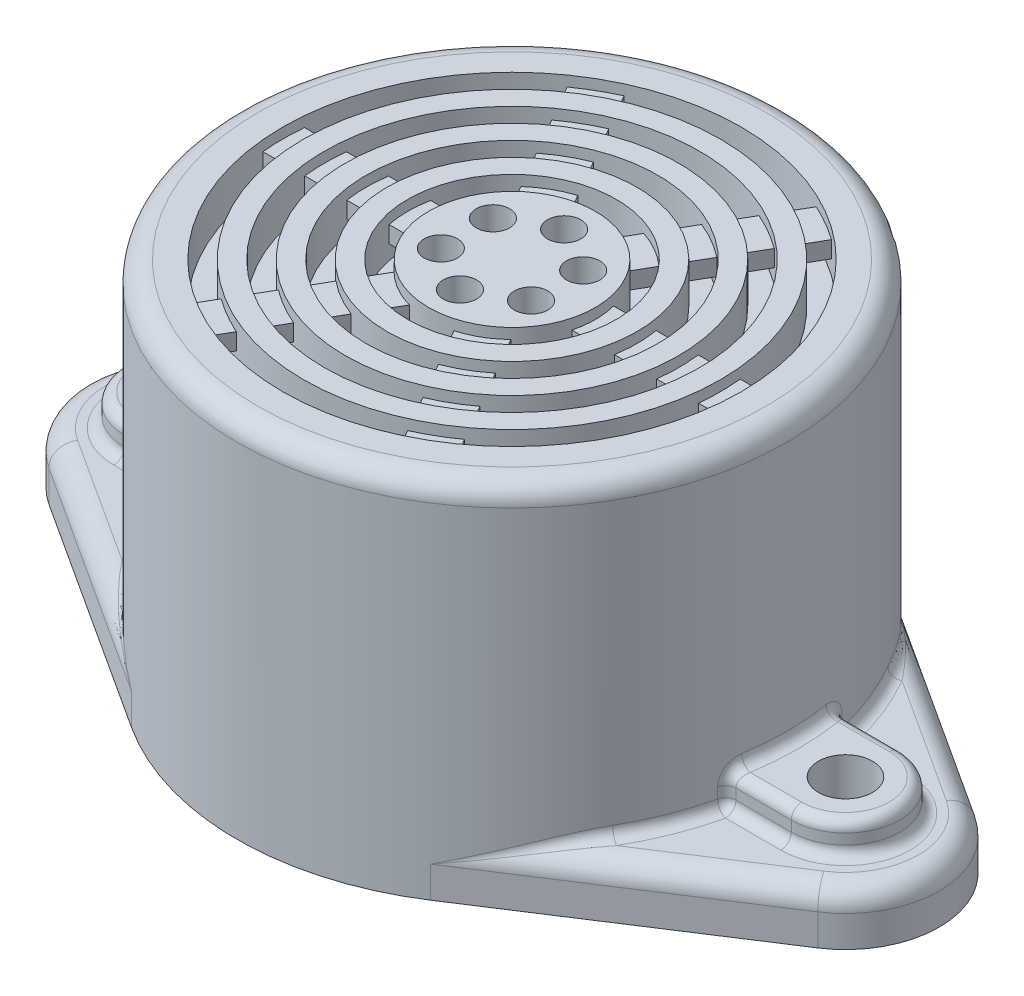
SolidWorks part; units mm, degrees
ref_plane "Face" through (0, 0, 0) normal (0, 0, 1) x (1, 0, 0)
ref_plane "Dessus" through (0, 0, 0) normal (0, 1, 0) x (1, 0, 0)
ref_plane "Droite" through (0, 0, 0) normal (1, 0, 0) x (0, 0, -1)
sketch "Esquisse1" plane through (0, 0, 0) normal (0, 1, 0) x (1, 0, 0)
  line L0 (-27.0489, 0) -> (27.9925, 0) construction
  line L1 (0, 17.0629) -> (0, -19.579) construction
  line L2 (7.1775, 11.0781) -> (18.4469, 3.7766)
  line L3 (-7.1775, 11.0781) -> (-18.4469, 3.7766)
  line L4 (7.1775, -11.0781) -> (18.4469, -3.7766)
  line L5 (-7.1775, -11.0781) -> (-18.4469, -3.7766)
  arc A0 (7.1775, 11.0781) -> (-7.1775, 11.0781) centre (0, 0) ccw
  arc A1 (-18.4469, 3.7766) -> (-18.4469, -3.7766) centre (-16, 0) ccw
  arc A2 (18.4469, 3.7766) -> (18.4469, -3.7766) centre (16, 0) cw
  arc A3 (-7.1775, -11.0781) -> (7.1775, -11.0781) centre (0, 0) ccw
  dimension "D1" = 26.4
  dimension "D3" = 9
  dimension "D2" = 41
extrude "Base-Extrusion" add sketch "Esquisse1" along normal blind 2.5
sketch "Esquisse2" plane through (0, 2.5, 0) normal (0, 1, 0) x (-1, 0, 0)
  circle A0 centre (0, 0) radius 13.2
  arc A1 (7.1775, 11.0781) -> (-7.1775, 11.0781) centre (0, 0) ccw construction
extrude "Boss.-Extru.1" add sketch "Esquisse2" along normal blind 15
sketch "Esquisse3" plane through (0, 2.5, 0) normal (0, 1, 0) x (-1, 0, 0)
  line L0 (16, -2.6) -> (12.9414, -2.6)
  line L1 (16, 2.6) -> (12.9414, 2.6)
  line L2 (-12.9414, -2.6) -> (-16, -2.6)
  line L3 (-12.9414, 2.6) -> (-16, 2.6)
  arc A0 (16, -2.6) -> (16, 2.6) centre (16, 0) ccw
  arc A1 (-16, 2.6) -> (-16, -2.6) centre (-16, 0) ccw
  arc A2 (18.4469, -3.7766) -> (18.4469, 3.7766) centre (16, 0) ccw construction
  arc A3 (-18.4469, 3.7766) -> (-18.4469, -3.7766) centre (-16, 0) ccw construction
  circle A4 centre (0, 0) radius 13.2 construction
  arc A5 (-12.9414, 2.6) -> (-12.9414, -2.6) centre (0, 0) ccw
  arc A6 (12.9414, -2.6) -> (12.9414, 2.6) centre (0, 0) ccw
  dimension "D1" = 2.6
extrude "Boss.-Extru.2" add sketch "Esquisse3" along normal blind 1.5
fillet "Congé1" radius 1 13 edges at (-20.5, 2.5, 0) (0, 17.5, 13.2) (20.5, 2.5, 0)
fillet "Congé2" radius 0.5 26 edges at (-12.9414, 3.25, 2.6) (-14.4707, 2.5, -2.6) (-12.9414, 3.25, -2.6) (-18.6, 2.5, 0) (-14.4707, 2.5, 2.6) (-13.2, 4, 0) (-14.4707, 4, -2.6) (-18.6, 4, 0) (-14.4707, 4, 2.6) (12.9414, 3.25, -2.6) (14.4707, 2.5, 2.6) (12.9414, 3.25, 2.6) (18.6, 2.5, 0) (14.4707, 2.5, -2.6) (13.2, 4, 0) (14.4707, 4, 2.6) (18.6, 4, 0) (14.4707, 4, -2.6) (9.6019, 2.2824, -9.0578) (-9.6019, 2.2824, -9.0578) (9.6019, 2.2824, 9.0578) (-9.6019, 2.2824, 9.0578)
sketch "Esquisse4" plane through (0, 4, 0) normal (0, 1, 0) x (-1, 0, 0)
  circle A0 centre (16, 0) radius 1.3
  circle A1 centre (-16, 0) radius 1.3
  arc A3 (16, -2.1) -> (16, 2.1) centre (16, 0) ccw construction
  arc A4 (-16, 2.1) -> (-16, -2.1) centre (-16, 0) ccw construction
  dimension "D1" = 2.6
extrude "Enlèv. mat.-Extru.1" cut sketch "Esquisse4" against normal up to next
sketch "Esquisse6" plane through (0, 0, 0) normal (0, 0, 1) x (1, 0, 0)
  line L0 (0, 19.0416) -> (0, -6.3521) construction
  line L1 (0, 4.5) -> (0, 3) construction
  line L2 (12.2, 17.5) -> (-12.2, 17.5) construction
  line L3 (-11, 17.5) -> (-10, 17.5)
  line L4 (-11, 17.5) -> (-11, 15.5)
  line L5 (-11, 15.5) -> (-10, 15.5)
  line L6 (-10, 17.5) -> (-10, 15.5)
  line L7 (-9, 17.5) -> (-8, 17.5)
  line L8 (-9, 17.5) -> (-9, 15.5)
  line L9 (-9, 15.5) -> (-8, 15.5)
  line L10 (-8, 17.5) -> (-8, 15.5)
  line L11 (-7, 17.5) -> (-6, 17.5)
  line L12 (-7, 17.5) -> (-7, 15.5)
  line L13 (-7, 15.5) -> (-6, 15.5)
  line L14 (-6, 17.5) -> (-6, 15.5)
  line L15 (-5, 17.5) -> (-4, 17.5)
  line L16 (-5, 17.5) -> (-5, 15.5)
  line L17 (-5, 15.5) -> (-4, 15.5)
  line L18 (-4, 17.5) -> (-4, 15.5)
  dimension "D1" = 2
  dimension "D2" = 8
  dimension "D3" = 1
  dimension "D4" = 22
  dimension "D5" = 1
  dimension "D6" = 1
revolve "Enlèvement de matière-Révolution1" cut sketch "Esquisse6" angle 360 about L0
sketch "Esquisse7" plane through (0, 17.5, 0) normal (0, 1, 0) x (-1, 0, 0)
  circle A0 centre (0, 0) radius 2.5 construction
  circle A1 centre (0, -2.5) radius 0.8
  circle A2 centre (-2.1651, -1.25) radius 0.8
  circle A3 centre (-2.1651, 1.25) radius 0.8
  circle A4 centre (0, 2.5) radius 0.8
  circle A5 centre (2.1651, 1.25) radius 0.8
  circle A6 centre (2.1651, -1.25) radius 0.8
  dimension "D1" = 5
  dimension "D2" = 1.6
extrude "Enlèv. mat.-Extru.2" cut sketch "Esquisse7" against normal up to surface (2 mm away)
ref_plane "Plan1" through (0, 17, 0) normal (0, 1, 0) x (-1, 0, 0)
sketch "Esquisse8" plane through (0, 17, 0) normal (0, 1, 0) x (-1, 0, 0)
  line L0 (15.6318, 0) -> (-21.6293, 0) construction
  line L1 (10.9545, -1) -> (3.873, -1)
  line L2 (10.9545, 1) -> (3.873, 1)
  line L3 (7.9287, -13.7329) -> (-8.705, 15.0776) construction
  line L4 (-3.873, -1) -> (-10.9545, -1)
  line L5 (-3.873, 1) -> (-10.9545, 1)
  line L6 (6.3433, -8.9868) -> (2.8025, -2.8541)
  line L7 (4.6112, -9.9868) -> (1.0705, -3.8541)
  line L8 (-2.8025, 2.8541) -> (-6.3433, 8.9868)
  line L9 (-1.0705, 3.8541) -> (-4.6112, 9.9868)
  line L10 (0, -13.7329) -> (0, 16.5261) construction
  line L11 (2.8025, 2.8541) -> (6.3433, 8.9868)
  line L12 (1.0705, 3.8541) -> (4.6112, 9.9868)
  line L13 (-6.3433, -8.9868) -> (-2.8025, -2.8541)
  line L14 (-4.6112, -9.9868) -> (-1.0705, -3.8541)
  circle A1 centre (0, 0) radius 11 construction
  arc A2 (4.6112, -9.9868) -> (6.3433, -8.9868) centre (0, 0) ccw
  circle A3 centre (0, 0) radius 4 construction
  arc A4 (1.0705, -3.8541) -> (2.8025, -2.8541) centre (0, 0) ccw
  arc A5 (10.9545, -1) -> (10.9545, 1) centre (0, 0) ccw
  arc A6 (6.3433, 8.9868) -> (4.6112, 9.9868) centre (0, 0) ccw
  arc A7 (-4.6112, 9.9868) -> (-6.3433, 8.9868) centre (0, 0) ccw
  arc A8 (-10.9545, 1) -> (-10.9545, -1) centre (0, 0) ccw
  arc A9 (-6.3433, -8.9868) -> (-4.6112, -9.9868) centre (0, 0) ccw
  arc A10 (-2.8025, -2.8541) -> (-1.0705, -3.8541) centre (0, 0) ccw
  arc A11 (-3.873, 1) -> (-3.873, -1) centre (0, 0) ccw
  arc A12 (-1.0705, 3.8541) -> (-2.8025, 2.8541) centre (0, 0) ccw
  arc A13 (2.8025, 2.8541) -> (1.0705, 3.8541) centre (0, 0) ccw
  arc A14 (3.873, -1) -> (3.873, 1) centre (0, 0) ccw
  dimension "D1" = 2
  dimension "D2" = 60
  dimension "D3" = 2
extrude "Boss.-Extru.3" add sketch "Esquisse8" against normal blind 0.8
